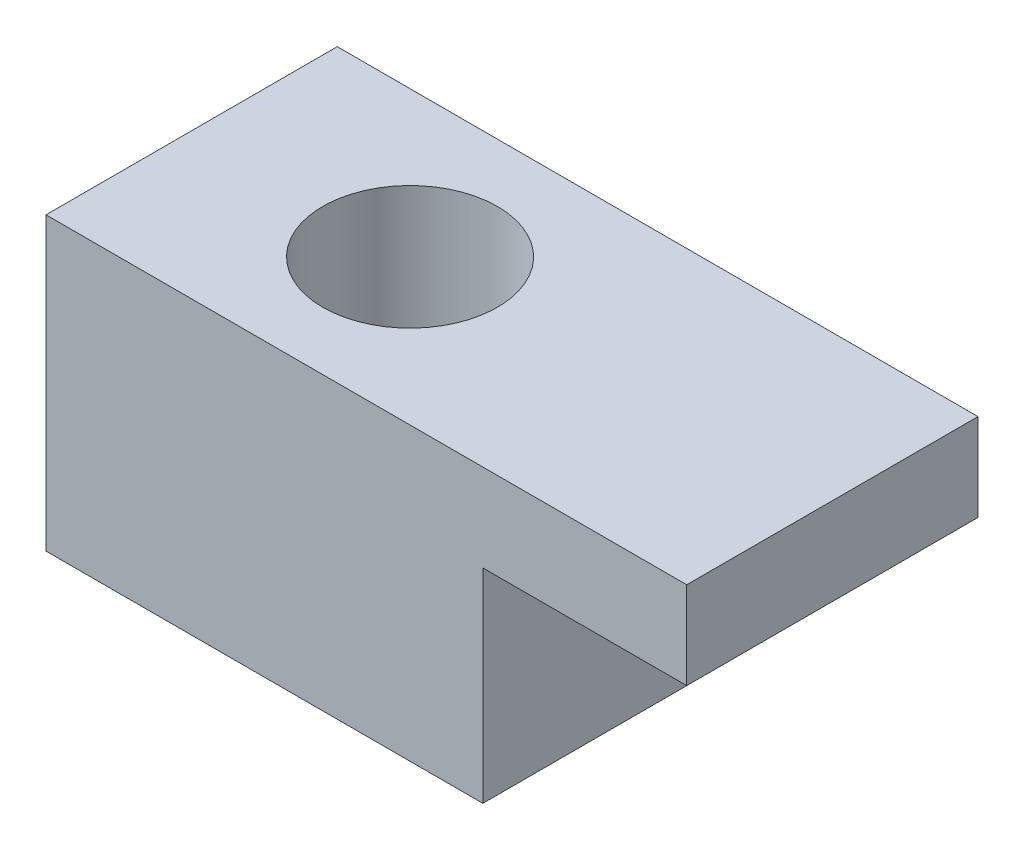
SolidWorks part; units mm, degrees
ref_plane "Front" through (0, 0, 0) normal (0, 0, 1) x (1, 0, 0)
ref_plane "Top" through (0, 0, 0) normal (0, 1, 0) x (1, 0, 0)
ref_plane "Right" through (0, 0, 0) normal (1, 0, 0) x (0, 0, -1)
sketch "Sketch1" plane through (0, 0, 0) normal (0, 0, 1) x (1, 0, 0)
  line L0 (15, 7) -> (22, 7)
  line L1 (0, 0) -> (15, 0)
  line L2 (0, 0) -> (0, 10)
  line L3 (0, 10) -> (22, 10)
  line L4 (22, 7) -> (22, 10)
  line L5 (15, 0) -> (15, 7)
  line L6 (22, 0) -> (22, 10) construction
  line L7 (15, 0) -> (15, 10) construction
  line L8 (0, 7) -> (22, 7) construction
  dimension "D1" = 15
  dimension "D2" = 10
  dimension "D3" = 7
  dimension "D4" = 3
  dimension "D5" = 22
extrude "Extrude1" add sketch "Sketch1" along normal blind 10
sketch "Sketch2" plane through (0, 10, 0) normal (0, 1, 0) x (-1, 0, 0)
  line L0 (0, 10) -> (0, 0) construction
  line L1 (-22, 0) -> (0, 0) construction
  circle A0 centre (-7.5, 5) radius 3
  dimension "D1" = 6
  dimension "D2" = 7.5
  dimension "D3" = 5
extrude "Cut-Extrude1" cut sketch "Sketch2" against normal through all
